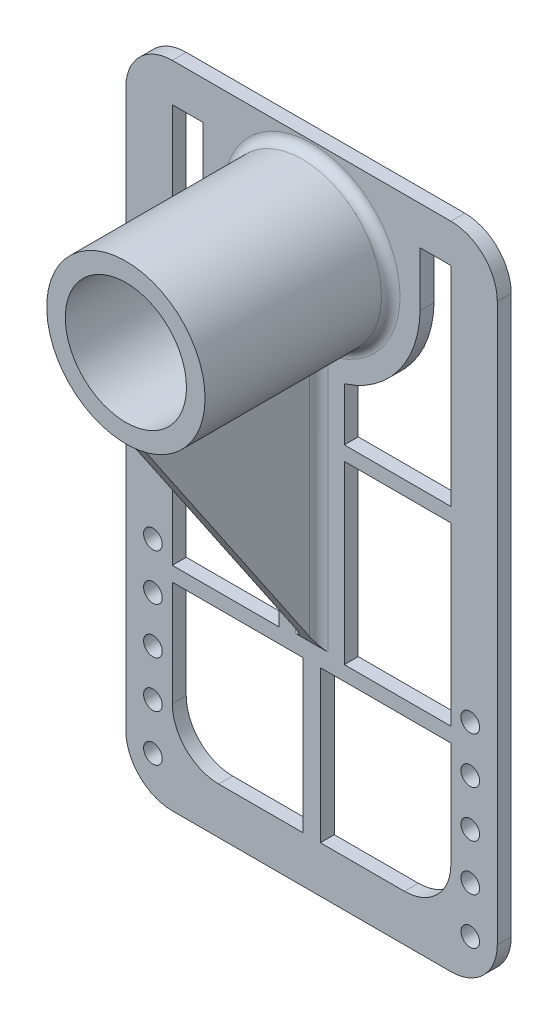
SolidWorks part; units mm, degrees
ref_plane "Plan de face" through (0, 0, 0) normal (0, 0, 1) x (1, 0, 0)
ref_plane "Plan de dessus" through (0, 0, 0) normal (0, 1, 0) x (1, 0, 0)
ref_plane "Plan de droite" through (0, 0, 0) normal (1, 0, 0) x (0, 0, -1)
sketch "Esquisse1" plane through (0, 0, 0) normal (0, 0, 1) x (1, 0, 0)
  line L1 (40, 19.5) -> (-40, 19.5)
  line L2 (40, 19.5) -> (40, -120.5)
  line L3 (40, -120.5) -> (-40, -120.5)
  line L4 (-40, 19.5) -> (-40, -120.5)
  circle A0 centre (0, 0) radius 10
  dimension "D5" = 20
  dimension "D1" = 80
  dimension "D2" = 140
  dimension "D3" = 19.5
  dimension "D4" = 40
extrude "Boss.-Extru.1" add sketch "Esquisse1" along normal blind 3
sketch "Esquisse2" plane through (0, 0, 3) normal (0, 0, 1) x (1, 0, 0)
  circle A0 centre (0, 0) radius 13.05
  circle A2 centre (0, 0) radius 17.05
  dimension "D1" = 26.1
  dimension "D2" = 4
extrude "Boss.-Extru.2" add sketch "Esquisse2" along normal blind 40
fillet "Congé1" radius 2 1 edges at (-17.05, 0, 3)
sketch "Esquisse3" plane through (0, 0, 0) normal (1, 0, 0) x (0, 0, -1)
  line L0 (-43, -15.1533) -> (-3, -15.1533)
  line L1 (-43, 17.05) -> (-43, -17.05) construction
  line L2 (-3, 19.05) -> (-3, -19.05) construction
  line L3 (-3, -15.1533) -> (-3, -74.1246)
  line L4 (-3, -120.5) -> (-3, 19.5) construction
  line L5 (-3, -74.1246) -> (-43, -15.1533)
extrude "Boss.-Extru.3" add sketch "Esquisse3" along normal mid plane 3
fillet "Congé2" radius 2 6 edges at (-1.5, -16.9839, 23.3792) (-1.5, -20.494, 6.3242) (1.5, -16.9839, 23.3792) (1.5, -20.494, 6.3242) (-1.5, -46.5577, 3) (1.5, -46.5577, 3)
sketch "Esquisse4" plane through (0, 0, 3) normal (0, 0, 1) x (1, 0, 0)
  circle A0 centre (0, 0) radius 10 construction
  circle A1 centre (0, 0) radius 13.05
  circle A2 centre (0, 0) radius 13.05
  circle A3 centre (0, 0) radius 10
  dimension "D1" = 0
extrude "Boss.-Extru.4" add sketch "Esquisse4" along normal blind 15
fillet "Congé3" radius 10 4 edges at (40, -120.5, 1.5) (-40, -120.5, 1.5) (-40, 19.5, 1.5) (40, 19.5, 1.5)
sketch "Esquisse5" plane through (0, 0, 3) normal (0, 0, 1) x (1, 0, 0)
  line L0 (-20, -110.5) -> (-1.8959, -110.5)
  line L1 (30, -100.5) -> (30, -77.8415)
  line L3 (-30, -0.5) -> (-30, -33.7076)
  line L4 (-30, -120.5) -> (30, -120.5)
  line L5 (40, -110.5) -> (40, 9.5)
  line L6 (30, 19.5) -> (-30, 19.5)
  line L7 (-40, 9.5) -> (-40, -110.5)
  line L8 (-30, -120.5) -> (30, -120.5) construction
  line L9 (40, -110.5) -> (40, 9.5) construction
  line L10 (30, 19.5) -> (-30, 19.5) construction
  line L11 (-40, 9.5) -> (-40, -110.5) construction
  line L12 (30, -110.5) -> (30, 9.5) construction
  line L13 (-30, -110.5) -> (30, -110.5) construction
  line L14 (-30, 9.5) -> (-30, -110.5) construction
  line L15 (30, 9.5) -> (-30, 9.5) construction
  line L20 (0, 0) -> (0, -85.5486) construction
  line L23 (-7.0522, -22.2953) -> (-7.0522, -33.7076)
  line L24 (-7.0522, -77.8415) -> (-1.8959, -77.8415)
  line L25 (7.0522, -22.2953) -> (7.0522, -33.7076)
  line L27 (-30, -0.5) -> (-30, 11.2342)
  line L28 (-30, 11.2342) -> (-23.3787, 11.2342)
  line L29 (-23.3787, -0.5) -> (-23.3787, 11.2342)
  line L31 (23.3787, -0.5) -> (23.3787, 11.2342)
  line L32 (23.3787, 11.2342) -> (30, 11.2342)
  line L33 (30, -0.5) -> (30, 11.2342)
  line L34 (-30, -33.7076) -> (-7.0522, -33.7076)
  line L36 (-30, -36.7772) -> (-7.0522, -36.7772)
  line L38 (-7.0522, -77.8415) -> (-30, -77.8415)
  line L40 (-7.0522, -74.6954) -> (-30, -74.6954)
  line L43 (-1.8959, -77.8415) -> (-1.8959, -110.5)
  line L45 (1.8959, -77.8415) -> (1.8959, -110.5)
  line L46 (7.0522, -74.6954) -> (30, -74.6954)
  line L48 (7.0522, -77.8415) -> (30, -77.8415)
  line L50 (30, -36.7772) -> (7.0522, -36.7772)
  line L52 (30, -33.7076) -> (7.0522, -33.7076)
  line L53 (-30, -77.8415) -> (-30, -100.5)
  line L54 (1.8959, -77.8415) -> (7.0522, -77.8415)
  line L55 (1.8959, -110.5) -> (20, -110.5)
  line L56 (30, -74.6954) -> (30, -36.7772)
  line L57 (7.0522, -36.7772) -> (7.0522, -74.6954)
  line L58 (30, -33.7076) -> (30, -0.5)
  line L59 (-7.0522, -36.7772) -> (-7.0522, -74.6954)
  line L60 (-30, -36.7772) -> (-30, -74.6954)
  arc A0 (-20, -110.5) -> (-30, -100.5) centre (-20, -100.5) cw
  arc A4 (30, -120.5) -> (40, -110.5) centre (30, -110.5) ccw
  arc A5 (40, 9.5) -> (30, 19.5) centre (30, 9.5) ccw
  arc A6 (-30, 19.5) -> (-40, 9.5) centre (-30, 9.5) ccw
  arc A7 (-40, -110.5) -> (-30, -120.5) centre (-30, -110.5) ccw
  arc A8 (30, -120.5) -> (40, -110.5) centre (30, -110.5) ccw construction
  arc A9 (40, 9.5) -> (30, 19.5) centre (30, 9.5) ccw construction
  arc A10 (-30, 19.5) -> (-40, 9.5) centre (-30, 9.5) ccw construction
  arc A11 (-40, -110.5) -> (-30, -120.5) centre (-30, -110.5) ccw construction
  arc A12 (30, -100.5) -> (20, -110.5) centre (20, -100.5) cw
  arc A13 (30, -110.5) -> (30, -110.5) centre (30, -110.5) ccw construction
  arc A14 (-30, -110.5) -> (-30, -110.5) centre (-30, -110.5) ccw construction
  arc A15 (-30, 9.5) -> (-30, 9.5) centre (-30, 9.5) ccw construction
  arc A16 (30, 9.5) -> (30, 9.5) centre (30, 9.5) ccw construction
  arc A17 (7.0522, -22.2953) -> (23.3787, -0.5) centre (0, 0) ccw
  arc A18 (-23.3787, -0.5) -> (-7.0522, -22.2953) centre (0, 0) ccw
  dimension "D3" = 10
  dimension "D1" = 0
  dimension "D2" = 10
extrude "Enlèv. mat.-Extru.1" cut sketch "Esquisse5" against normal through all
sketch "Esquisse6" plane through (0, 0, 0) normal (0, 0, -1) x (-1, 0, 0)
  line L0 (0, 0) -> (0, -126.7904) construction
  line L1 (0, 10) -> (0, -116.7904) construction
  line L2 (0, 20) -> (0, -106.7904) construction
  line L3 (0, 30) -> (0, -96.7904) construction
  line L4 (0, 40) -> (0, -86.7904) construction
  circle A0 centre (-34.1766, -111.8498) radius 2.0114
  circle A1 centre (34.1766, -111.8498) radius 2.0114
  circle A2 centre (-34.1766, -101.8498) radius 2.0114
  circle A3 centre (34.1766, -101.8498) radius 2.0114
  circle A4 centre (-34.1766, -91.8498) radius 2.0114
  circle A5 centre (34.1766, -91.8498) radius 2.0114
  circle A6 centre (-34.1766, -81.8498) radius 2.0114
  circle A7 centre (34.1766, -81.8498) radius 2.0114
  circle A8 centre (-34.1766, -71.8498) radius 2.0114
  circle A9 centre (34.1766, -71.8498) radius 2.0114
  dimension "D1" = 5
extrude "Enlèv. mat.-Extru.2" cut sketch "Esquisse6" against normal blind 10
